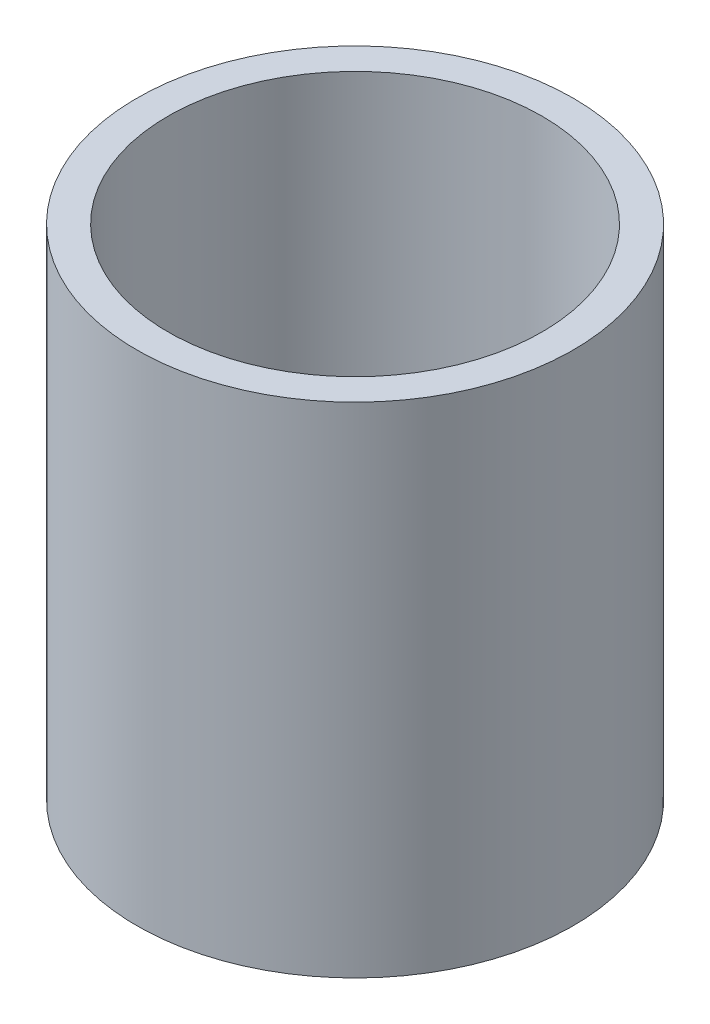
SolidWorks part; units mm, degrees
ref_plane "Front Plane" through (0, 0, 0) normal (0, 0, 1) x (1, 0, 0)
ref_plane "Top Plane" through (0, 0, 0) normal (0, 1, 0) x (1, 0, 0)
ref_plane "Right Plane" through (0, 0, 0) normal (1, 0, 0) x (0, 0, -1)
sketch "Sketch1" plane through (0, 0, 0) normal (0, 0, 1) x (1, 0, 0)
  line L0 (0, 0) -> (0, 19.8611) construction
  line L1 (-4.7625, 0) -> (-5.5562, 0)
  line L2 (-4.7625, 0) -> (-4.7625, 12.7)
  line L3 (-4.7625, 12.7) -> (-5.5562, 12.7)
  line L4 (-5.5562, 0) -> (-5.5562, 12.7)
  dimension "D1" = 9.525
  dimension "D2" = 11.1125
  dimension "D3" = 12.7
revolve "Revolve1" add sketch "Sketch1" angle 360 about L0
